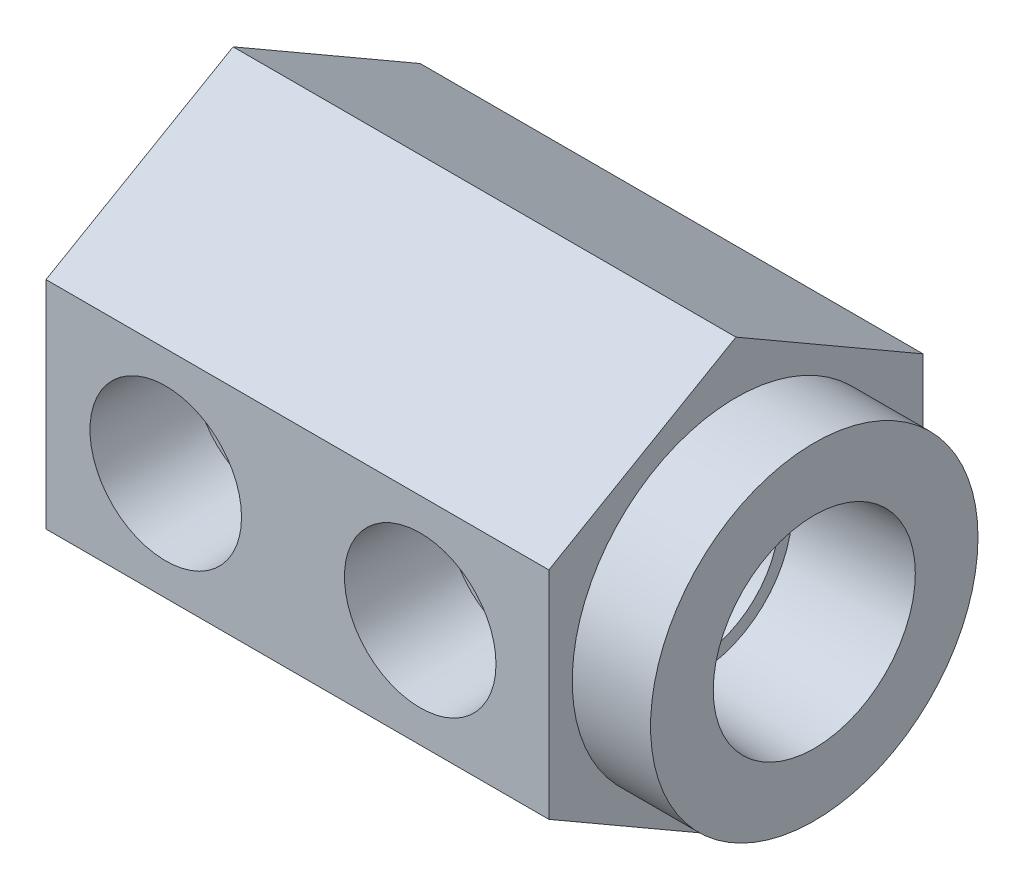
SolidWorks part; units mm, degrees
ref_plane "Front Plane" through (0, 0, 0) normal (0, 0, 1) x (1, 0, 0)
ref_plane "Top Plane" through (0, 0, 0) normal (0, 1, 0) x (1, 0, 0)
ref_plane "Right Plane" through (0, 0, 0) normal (1, 0, 0) x (0, 0, -1)
sketch "Sketch1" plane through (0, 0, 0) normal (1, 0, 0) x (0, 0, -1)
  line L0 (0, 16.1312) -> (0, -16.1312) construction
  line L1 (-12.7, -7.3323) -> (0, -14.6647)
  line L2 (0, -14.6647) -> (12.7, -7.3323)
  line L3 (12.7, -7.3323) -> (12.7, 7.3323)
  line L4 (12.7, 7.3323) -> (0, 14.6647)
  line L5 (0, 14.6647) -> (-12.7, 7.3323)
  line L6 (-12.7, 7.3323) -> (-12.7, -7.3323)
  circle A0 centre (0, 0) radius 12.7 construction
  dimension "D1" = 25.4
extrude "Boss-Extrude1" add sketch "Sketch1" along normal blind 34.1313 separate body
sketch "Sketch2" plane through (34.1313, 0, 0) normal (1, 0, 0) x (0, 0, -1)
  circle A1 centre (0, 0) radius 11.1125
  dimension "D1" = 22.225
extrude "Boss-Extrude2" add sketch "Sketch2" along normal blind 5.3162
sketch "Sketch3" plane through (0, 0, 0) normal (0, 0, 1) x (1, 0, 0)
  line L8 (39.4475, 6.8581) -> (31.51, 6.4421)
  line L9 (31.51, 5.5562) -> (31.51, 6.4421)
  line L10 (31.51, 5.5562) -> (21.0325, 5.5562)
  line L11 (21.0325, 0) -> (21.0325, 5.5562)
  line L12 (39.4475, -11.1125) -> (39.4475, 11.1125) construction
  line L13 (39.4475, 0) -> (39.4475, 6.8581)
  line L14 (0, 0) -> (50000, 0) construction
  line L15 (0, 7.3323) -> (0, -7.3323) construction
  line L16 (21.0325, 0) -> (39.4475, 0)
  point P11 (0, 0)
  dimension "D1" = 11.1125
  dimension "D2" = 13.7161
  dimension "D3" = 3
  dimension "D4" = 7.9375
  dimension "D5" = 18.415
revolve "Cut-Revolve1" cut sketch "Sketch3" angle 360 about L14
hole_wizard "1/8 NPT Tapped Hole1" positions "Sketch5" profile "Sketch4" size "1/8" standard "Ansi Inch"
sketch "Sketch5" plane through (0, 0, 12.7) normal (0, 0, 1) x (1, 0, 0)
  line L0 (13.97, 0) -> (-13.97, 0) construction
  line L1 (0, -13.97) -> (0, 13.97) construction
  point P0 (8.128, 0)
  point P2 (25.4, 0)
  dimension "D1" = 25.4
  dimension "D2" = 8.128
sketch "Sketch4" plane through (8.128, 0, 12.7) normal (1, 0, 0) x (0, -1, 0)
  line L0 (0, 0) -> (0, 14.1565)
  line L1 (4.2164, 11.623) -> (0, 14.1565)
  line L2 (-4.2164, 11.623) -> (0, 14.1565) construction
  line L3 (4.2164, 11.623) -> (4.2164, 6.924)
  line L4 (4.2164, 6.924) -> (4.9362, 6.924)
  line L5 (4.9362, 6.924) -> (5.1435, 0)
  line L6 (-4.9362, 6.924) -> (-5.1435, 0) construction
  line L7 (5.1435, 0) -> (0, 0)
  line L8 (0, -6.35) -> (0, 107.95) construction
  line L11 (-4.2164, 6.924) -> (-4.9362, 6.924) construction
  dimension "Tap Drill Dia." = 8.4328
  dimension "Tap Drill Depth" = 11.623
  dimension "Thread Dia." = 10.287
  dimension "Thread Angle" = 3.43
  dimension "Thread Depth" = 6.924
  dimension "Drill Angle" = 118
hole_wizard "1/8 NPT Tapped Hole2" positions "Sketch7" profile "Sketch6" size "1/8" standard "Ansi Inch"
sketch "Sketch7" plane through (0, 0, -12.7) normal (0, 0, -1) x (-1, 0, 0)
  circle A0 centre (-8.128, 0) radius 5.1435 construction
  point P0 (-8.128, 0)
sketch "Sketch6" plane through (8.128, 0, -12.7) normal (1, 0, 0) x (0, 1, 0)
  line L0 (0, 0) -> (0, 18.4085)
  line L1 (4.2164, 15.875) -> (0, 18.4085)
  line L2 (-4.2164, 15.875) -> (0, 18.4085) construction
  line L3 (4.2164, 15.875) -> (4.2164, 6.924)
  line L4 (4.2164, 6.924) -> (4.9362, 6.924)
  line L5 (4.9362, 6.924) -> (5.1435, 0)
  line L6 (-4.9362, 6.924) -> (-5.1435, 0) construction
  line L7 (5.1435, 0) -> (0, 0)
  line L8 (0, -6.35) -> (0, 107.95) construction
  line L11 (-4.2164, 6.924) -> (-4.9362, 6.924) construction
  dimension "Tap Drill Dia." = 8.4328
  dimension "Tap Drill Depth" = 15.875
  dimension "Thread Dia." = 10.287
  dimension "Thread Angle" = 3.43
  dimension "Thread Depth" = 6.924
  dimension "Drill Angle" = 118
hole_wizard "1/4 (0.25) Diameter Hole1" positions "Sketch9" profile "Sketch8" hole size "1/4" standard "Ansi Inch"
sketch "Sketch9" plane through (39.4475, 0, 0) normal (1, 0, 0) x (0, 0, -1)
  circle A0 centre (0, 0) radius 6.8581 construction
  point P0 (0, 0)
sketch "Sketch8" plane through (39.4475, 0, 0) normal (0, 1, 0) x (0, 0, -1)
  line L0 (0, 0) -> (0, 27.3077)
  line L1 (0, 27.3077) -> (3.175, 25.4)
  line L2 (3.175, 25.4) -> (3.175, 0)
  line L5 (3.175, 0) -> (0, 0)
  line L10 (0, 27.3077) -> (-3.175, 25.4) construction
  line L11 (0, -6.35) -> (0, 107.95) construction
  dimension "Hole Dia." = 6.35
  dimension "Hole Depth" = 25.4
  dimension "Drill Angle" = 118
hole_wizard "7/32 (0.21875) Diameter Hole1" positions "Sketch11" profile "Sketch10" hole size "7/32" standard "Ansi Inch"
sketch "Sketch11" plane through (39.4475, 0, 0) normal (1, 0, 0) x (0, 0, -1)
  circle A0 centre (0, 0) radius 6.8581 construction
  point P0 (0, 0)
sketch "Sketch10" plane through (39.4475, 0, 0) normal (0, 1, 0) x (0, 0, -1)
  line L0 (0, 0) -> (0, 33.4193)
  line L1 (0, 33.4193) -> (2.7781, 31.75)
  line L2 (2.7781, 31.75) -> (2.7781, 0)
  line L5 (2.7781, 0) -> (0, 0)
  line L10 (0, 33.4193) -> (-2.7781, 31.75) construction
  line L11 (0, -6.35) -> (0, 107.95) construction
  dimension "Hole Dia." = 5.5562
  dimension "Hole Depth" = 31.75
  dimension "Drill Angle" = 118
